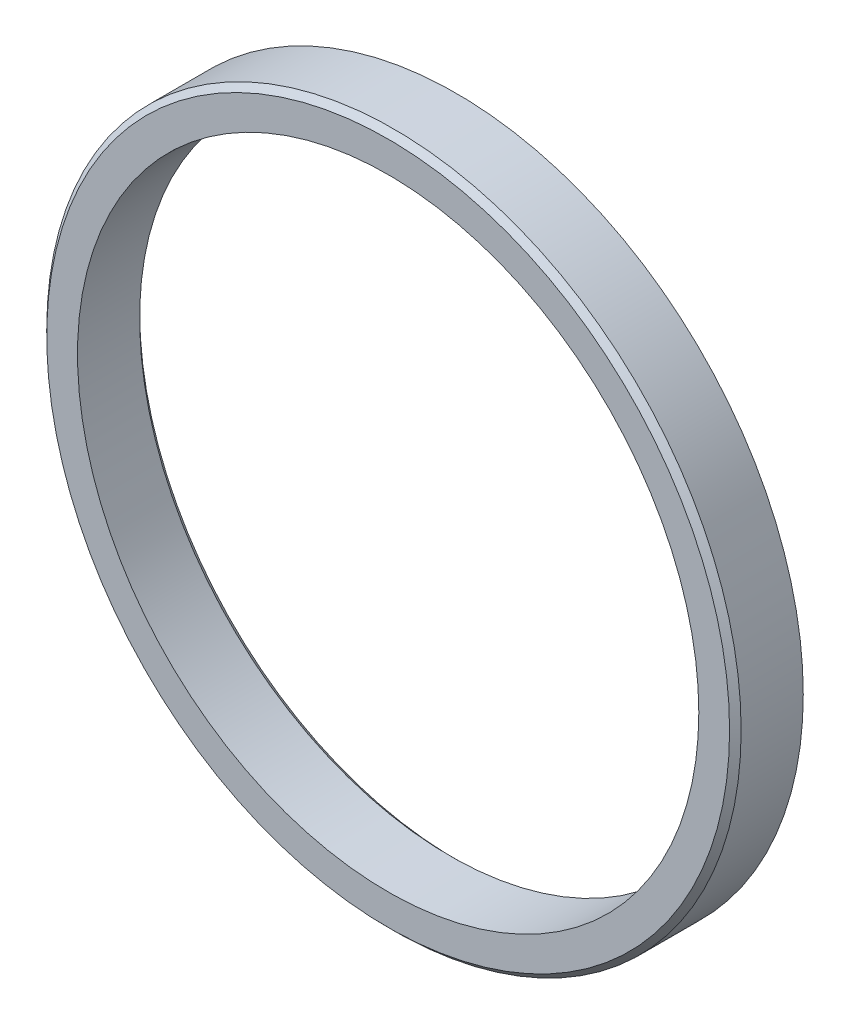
SolidWorks part; units mm, degrees
ref_plane "Front Plane" through (0, 0, 0) normal (0, 0, 1) x (1, 0, 0)
ref_plane "Top Plane" through (0, 0, 0) normal (0, 1, 0) x (1, 0, 0)
ref_plane "Right Plane" through (0, 0, 0) normal (1, 0, 0) x (0, 0, -1)
sketch "Sketch1" plane through (0, 0, 0) normal (1, 0, 0) x (0, 0, -1)
  line L0 (-66.6227, 0) -> (66.6227, 0) construction
  line L1 (-10.75, 107.5) -> (10.75, 107.5)
  line L2 (10.75, 107.5) -> (12.75, 109.5)
  line L3 (12.75, 109.5) -> (12.75, 120.15)
  line L4 (12.75, 120.15) -> (-8.75, 120.15)
  line L5 (-8.75, 120.15) -> (-10.75, 118.15)
  line L6 (-10.75, 118.15) -> (-10.75, 107.5)
  line L7 (0, -152.3213) -> (0, 152.3213) construction
  point P3 (0, 107.5)
  point P4 (0, 0)
  point P13 (0, 0)
  dimension "D1" = 45
  dimension "D2" = 45
  dimension "D3" = 2
  dimension "D4" = 2
  dimension "D5" = 215
  dimension "D6" = 240.3
  dimension "D7" = 23.5
revolve "Revolve1" add sketch "Sketch1" angle 360 about L0
